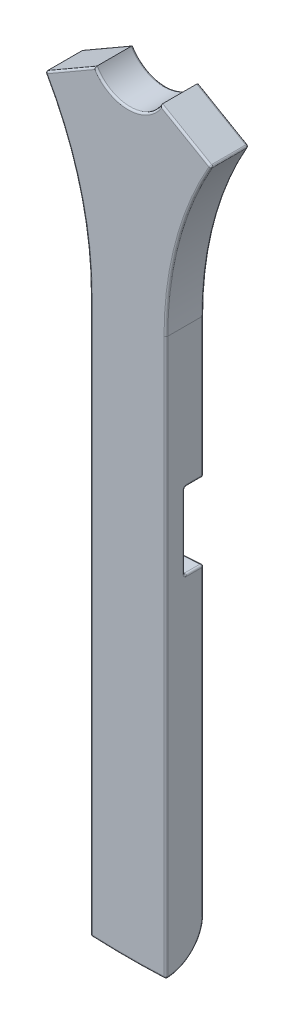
SolidWorks part; units mm, degrees
ref_plane "Спереди" through (0, 0, 0) normal (0, 0, 1) x (1, 0, 0)
ref_plane "Сверху" through (0, 0, 0) normal (0, 1, 0) x (1, 0, 0)
ref_plane "Справа" through (0, 0, 0) normal (1, 0, 0) x (0, 0, -1)
sketch "Эскиз1" plane through (0, 0, 0) normal (0, 0, 1) x (1, 0, 0)
  line L0 (0, 0) -> (0, -205) construction
  line L1 (-10, -57.6091) -> (-10, -204.756)
  line L2 (-8.6603, -5) -> (-22.0285, -12.7182)
  line L3 (10, -57.6091) -> (10, -204.756)
  line L4 (8.6603, -5) -> (22.0285, -12.7182)
  arc A0 (-10, -204.756) -> (10, -204.756) centre (0, 0) ccw
  circle A1 centre (0, 0) radius 25 construction
  arc A2 (-10, -57.6091) -> (-22.0285, -12.7182) centre (-99.7818, -57.6091) ccw
  arc A3 (-8.6603, -5) -> (8.6603, -5) centre (0, 0) ccw
  arc A4 (10, -57.6091) -> (22.0285, -12.7182) centre (99.7818, -57.6091) cw
  dimension "D1" = 410
  dimension "D4" = 50
  dimension "D5" = 20
  dimension "D2" = 20
  dimension "D3" = 60
extrude "Бобышка-Вытянуть1" add sketch "Эскиз1" along normal blind 10
sketch "Эскиз2" plane through (0, 0, 0) normal (0, 0, -1) x (-1, 0, 0)
  line L0 (-10, -204.756) -> (-10, -57.6091) construction
  line L1 (10, -57.6091) -> (10, -204.756) construction
  line L2 (-10, -114.5644) -> (-10, -94.4722)
  line L3 (10, -94.4722) -> (10, -114.5644)
  arc A0 (-10, -114.5644) -> (10, -114.5644) centre (0, 0) ccw
  arc A1 (-10, -94.4722) -> (10, -94.4722) centre (0, 0) ccw
  circle A2 centre (0, 0) radius 95 construction
  circle A3 centre (0, 0) radius 115 construction
  dimension "D1" = 230
  dimension "D2" = 20
extrude "Вырез-Вытянуть1" cut sketch "Эскиз2" against normal blind 5
fillet "Скругление2" radius 10 1 edges at (0, -205, 0)
fillet "Скругление1" radius 0.5 31 edges at (-10, -114.5644, 2.5) (-10, -94.4722, 2.5) (10, -114.5644, 2.5) (10, -94.4722, 2.5) (-10, -104.5183, 5) (0, -115, 5) (10, -104.5183, 5) (0, -95, 5) (10, -154.6539, 0) (0, -115, 0) (-10, -154.6539, 0) (13.0592, -34.3718, 0) (15.3444, -8.8591, 0) (0, -10, 0) (-15.3444, -8.8591, 0) (-13.0592, -34.3718, 0) (-10, -76.0406, 0) (0, -95, 0) (10, -76.0406, 0) (-15.3444, -8.8591, 10) (0, -10, 10) (15.3444, -8.8591, 10) (13.0592, -34.3718, 10) (10, -131.1825, 10) (-10, -131.1825, 10) (-13.0592, -34.3718, 10) (-22.0285, -12.7182, 5) (22.0285, -12.7182, 5) (0, -205, 10) (-10, -201.0043, 2.1961) (10, -202.5666, 3.7587)
